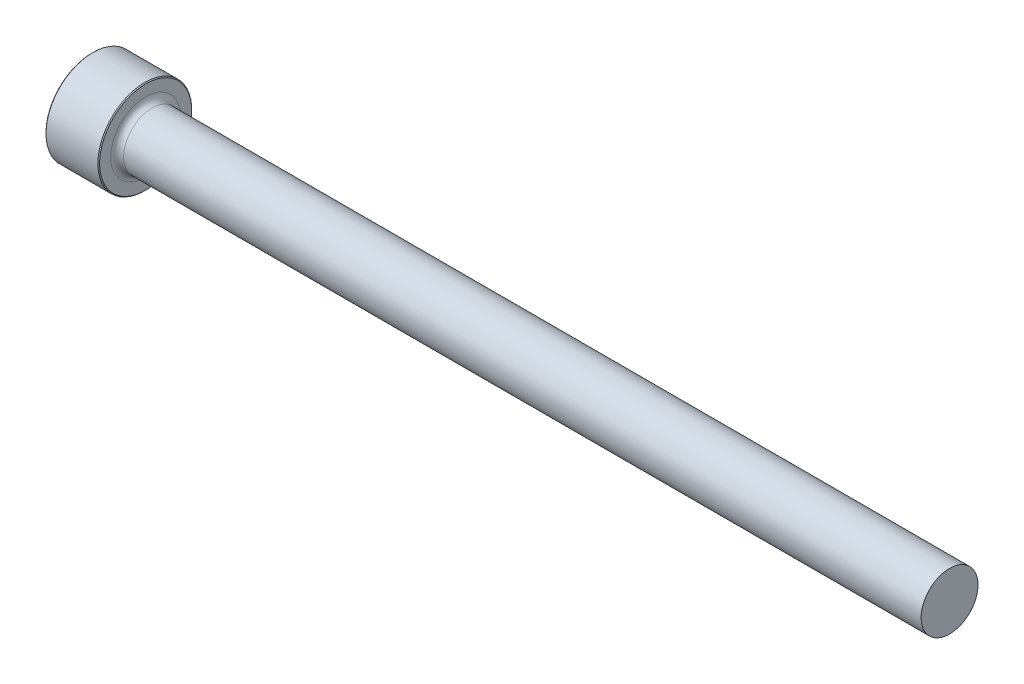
SolidWorks part; units mm, degrees
ref_plane "Front Plane" through (0, 0, 0) normal (0, 0, 1) x (1, 0, 0)
ref_plane "Top Plane" through (0, 0, 0) normal (0, 1, 0) x (1, 0, 0)
ref_plane "Right Plane" through (0, 0, 0) normal (1, 0, 0) x (0, 0, -1)
sketch "Sketch1" plane through (0, 0, 0) normal (0, 0, 1) x (1, 0, 0)
  line L0 (0, 0) -> (0, 5.5562)
  line L1 (0, 5.5562) -> (6.35, 5.5562)
  line L2 (6.35, 5.5562) -> (6.35, 4.1316)
  line L3 (7.112, 3.3696) -> (101.6, 3.3696)
  line L4 (101.6, 3.3696) -> (101.6, 0)
  line L5 (101.6, 0) -> (0, 0)
  line L6 (101.6, 0) -> (101.6, -3.3696) construction
  line L7 (101.6, -3.3696) -> (6.35, -3.3696) construction
  line L8 (0, 0) -> (0, -5.5562) construction
  line L9 (0, -5.5562) -> (6.35, -5.5562) construction
  line L10 (6.35, -5.5562) -> (6.35, -3.3696) construction
  arc A0 (6.35, 4.1316) -> (7.112, 3.3696) centre (7.112, 4.1316) ccw
  dimension "D4" = 0.762
  dimension "L" = 101.6
  dimension "D" = 6.7393
  dimension "H" = 11.1125
  dimension "T" = 6.35
revolve "Revolve1" add sketch "Sketch1" angle 360 about L5
chamfer "Chamfer1" distance 0.1016 angle 45 2 edges at (0, 5.5562, 0) (6.35, 5.5562, 0)
